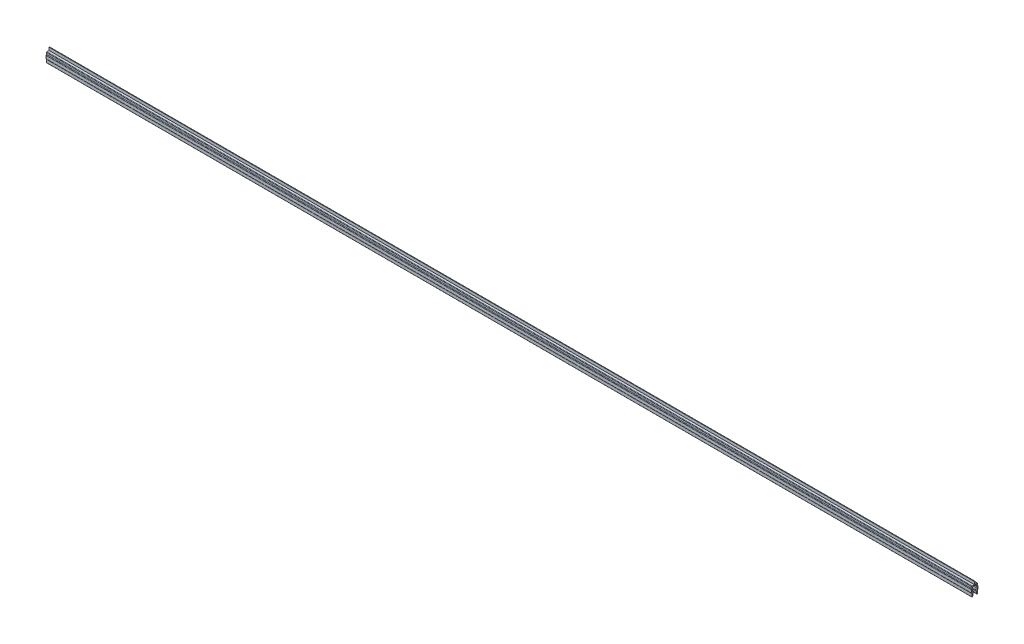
SolidWorks part; units mm, degrees
ref_plane "正面" through (0, 0, 0) normal (0, 0, 1) x (1, 0, 0)
ref_plane "平面" through (0, 0, 0) normal (0, 1, 0) x (1, 0, 0)
ref_plane "右側面" through (0, 0, 0) normal (1, 0, 0) x (0, 0, -1)
sketch "ｽｹｯﾁ1" plane through (0, 0, 0) normal (1, 0, 0) x (0, 0, -1)
  line L0 (-0.3, 0) -> (-0.3, 3)
  line L1 (-0.3, 3) -> (0.3, 3)
  line L2 (0.3, 3) -> (0.3, 0)
  line L3 (-0.3, 0) -> (-2.6164, 0)
  line L48 (-2.0164, -9.4834) -> (-2.5164, -10.3494)
  line L49 (-2.5164, -10.3494) -> (-2.7164, -10.3494)
  line L50 (-3.0164, -10.0494) -> (-3.0164, -7.0359)
  line L51 (-2.0164, -9.4834) -> (-2.0164, -7.4155)
  line L52 (-0.8966, -6.2427) -> (-1.8378, -7.0325)
  line L53 (-1.8164, -5.8895) -> (-1.0252, -5.8895)
  line L54 (-3.6164, -5.9966) -> (-3.6164, -3.0741)
  line L55 (-2.6164, -5.0895) -> (-2.6164, -3.6396)
  line L56 (-2.1164, -2.7736) -> (-2.1164, -1.5)
  line L57 (-3.1164, -2.0494) -> (-3.1164, -0.5)
  line L58 (3.1164, -2.2081) -> (3.1164, -0.5)
  line L59 (2.6164, -5.0895) -> (2.6164, -3.6396)
  line L60 (3.6164, -5.9966) -> (3.6164, -3.0741)
  line L61 (3.0164, -10.0494) -> (3.0164, -7.0359)
  line L62 (2.1164, -2.7736) -> (2.1164, -1.5)
  line L63 (1.8164, -5.8895) -> (1.0252, -5.8895)
  line L64 (0.8966, -6.2427) -> (1.8378, -7.0325)
  line L65 (1.6164, -1) -> (-1.6164, -1)
  line L66 (2.6164, 0) -> (0.3, 0)
  line L67 (2.0164, -9.4834) -> (2.5164, -10.3494)
  line L68 (2.0164, -9.4834) -> (2.0164, -7.4155)
  line L69 (2.5164, -10.3494) -> (2.7164, -10.3494)
  arc A50 (-3.0164, -10.0494) -> (-2.7164, -10.3494) centre (-2.7164, -10.0494) ccw
  arc A51 (-3.6164, -5.9966) -> (-3.3664, -6.4297) centre (-3.1164, -5.9966) ccw
  arc A52 (-3.0164, -7.0359) -> (-3.3664, -6.4297) centre (-3.7164, -7.0359) ccw
  arc A53 (-2.6164, -5.0895) -> (-1.8164, -5.8895) centre (-1.8164, -5.0895) ccw
  arc A54 (-3.4241, -2.68) -> (-3.6164, -3.0741) centre (-3.1164, -3.0741) ccw
  arc A55 (-3.4241, -2.68) -> (-3.1164, -2.0494) centre (-3.9164, -2.0494) ccw
  arc A56 (-2.3664, -3.2066) -> (-2.1164, -2.7736) centre (-2.6164, -2.7736) ccw
  arc A57 (-2.3664, -3.2066) -> (-2.6164, -3.6396) centre (-2.1164, -3.6396) ccw
  arc A58 (1.8164, -5.8895) -> (2.6164, -5.0895) centre (1.8164, -5.0895) ccw
  arc A59 (3.3664, -6.4297) -> (3.6164, -5.9966) centre (3.1164, -5.9966) ccw
  arc A60 (3.6164, -3.0741) -> (3.3664, -2.6411) centre (3.1164, -3.0741) ccw
  arc A61 (2.6164, -3.6396) -> (2.3664, -3.2066) centre (2.1164, -3.6396) ccw
  arc A62 (3.3664, -6.4297) -> (3.0164, -7.0359) centre (3.7164, -7.0359) ccw
  arc A63 (2.7164, -10.3494) -> (3.0164, -10.0494) centre (2.7164, -10.0494) ccw
  arc A64 (2.1164, -2.7736) -> (2.3664, -3.2066) centre (2.6164, -2.7736) ccw
  arc A65 (-0.8966, -6.2427) -> (-1.0252, -5.8895) centre (-1.0252, -6.0895) ccw
  arc A66 (-1.8378, -7.0325) -> (-2.0164, -7.4155) centre (-1.5164, -7.4155) ccw
  arc A67 (2.0164, -7.4155) -> (1.8378, -7.0325) centre (1.5164, -7.4155) ccw
  arc A68 (1.0252, -5.8895) -> (0.8966, -6.2427) centre (1.0252, -6.0895) ccw
  arc A69 (3.1164, -2.2081) -> (3.3664, -2.6411) centre (3.6164, -2.2081) ccw
  arc A70 (2.1164, -1.5) -> (1.6164, -1) centre (1.6164, -1.5) ccw
  arc A71 (3.1164, -0.5) -> (2.6164, 0) centre (2.6164, -0.5) ccw
  arc A72 (-1.6164, -1) -> (-2.1164, -1.5) centre (-1.6164, -1.5) ccw
  arc A73 (-2.6164, 0) -> (-3.1164, -0.5) centre (-2.6164, -0.5) ccw
  dimension "D1" = 0.3
  dimension "D2" = 0.6
extrude "押し出し1" add sketch "ｽｹｯﾁ1" along normal blind 1000
